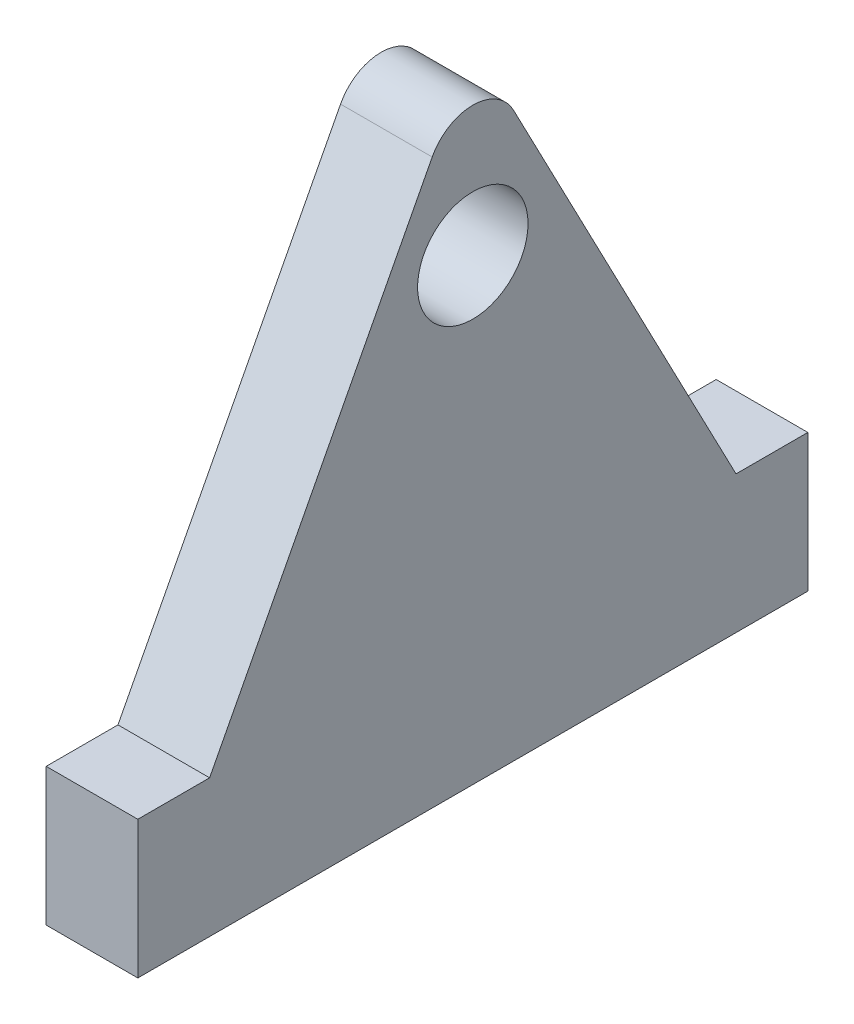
SolidWorks part; units mm, degrees
ref_plane "Front Plane" through (0, 0, 0) normal (0, 0, 1) x (1, 0, 0)
ref_plane "Top Plane" through (0, 0, 0) normal (0, 1, 0) x (1, 0, 0)
ref_plane "Right Plane" through (0, 0, 0) normal (1, 0, 0) x (0, 0, -1)
sketch "Sketch1" plane through (0, 0, 0) normal (1, 0, 0) x (0, 0, -1)
  line L0 (-8.8644, 53.023) -> (-73.0996, -70)
  line L3 (-73.0996, -70) -> (73.0996, -70)
  line L6 (-73.0996, -70) -> (24.3665, 23.3333) construction
  line L7 (8.8644, 53.023) -> (73.0996, -70)
  line L10 (-24.3665, 23.3333) -> (73.0996, -70) construction
  arc A1 (8.8644, 53.023) -> (-8.8644, 53.023) centre (0, 48.3945) ccw
  point P1 (0, 0)
  point P7 (0, -70)
  point P12 (0, 70)
  dimension "D4" = 10
  dimension "D1" = 140
extrude "Boss-Extrude1" add sketch "Sketch1" along normal blind 30 contours L0 L3 L7 A1
sketch "Sketch2" plane through (30, 0, 0) normal (1, 0, 0) x (0, 0, -1)
  line L0 (-73.0996, -70) -> (73.0996, -70) construction
  circle A3 centre (0, 30) radius 12.05
  dimension "D1" = 100
  dimension "D4" = 24.1
sketch "Sketch3" plane through (0, -70, 0) normal (0, -1, 0) x (1, 0, 0)
  line L1 (0, 73.0996) -> (30, 73.0996)
  line L2 (0, 73.0996) -> (0, -73.0996)
  line L3 (0, -73.0996) -> (30, -73.0996)
  line L4 (30, 73.0996) -> (30, -73.0996)
extrude "Boss-Extrude2" add sketch "Sketch3" against normal blind 30
sketch "Sketch6" plane through (0, 0, -73.0996) normal (0, 0, -1) x (-1, 0, 0)
  line L1 (0, -70) -> (-10, -70)
  line L2 (0, -70) -> (0, 63.2451)
  line L3 (0, 63.2451) -> (-10, 63.2451)
  line L4 (-10, -70) -> (-10, 63.2451)
  dimension "D1" = 10
extrude "Cut-Extrude5" cut sketch "Sketch6" against normal through all both and the other way through all
extrude "Cut-Extrude6" cut sketch "Sketch2" against normal through all both and the other way through all
